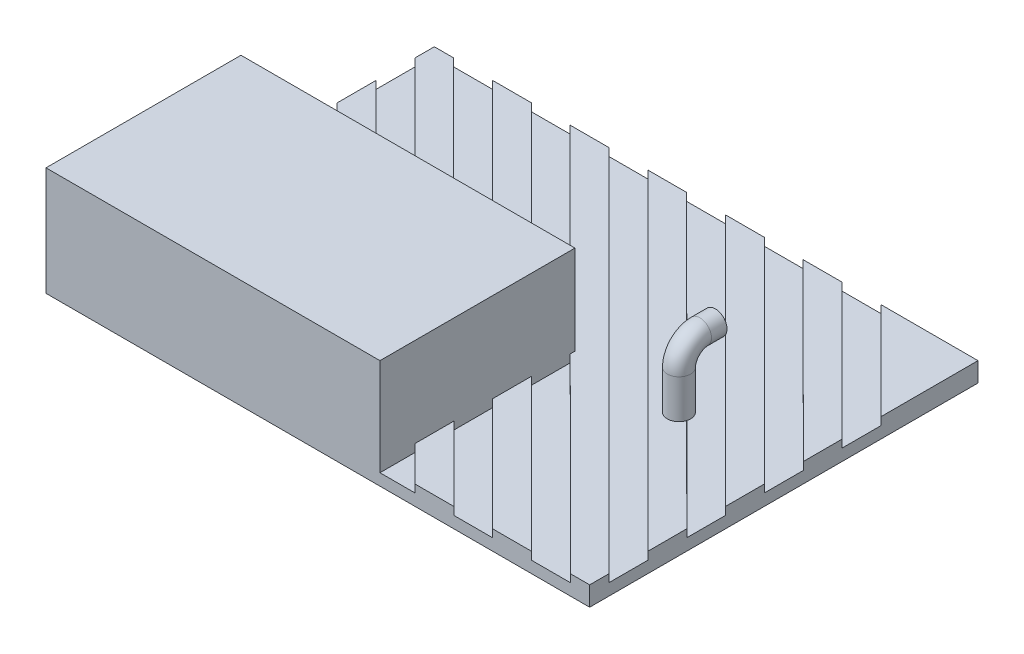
SolidWorks part; units mm, degrees
ref_plane "Front Plane" through (0, 0, 0) normal (0, 0, 1) x (1, 0, 0)
ref_plane "Top Plane" through (0, 0, 0) normal (0, 1, 0) x (1, 0, 0)
ref_plane "Right Plane" through (0, 0, 0) normal (1, 0, 0) x (0, 0, -1)
sketch "Sketch1" plane through (0, 0, 0) normal (0, 1, 0) x (1, 0, 0)
  line L1 (0, 0) -> (177.8, 0)
  line L2 (0, 0) -> (0, 127)
  line L3 (0, 127) -> (177.8, 127)
  line L4 (177.8, 0) -> (177.8, 127)
  dimension "D1" = 177.8
  dimension "D2" = 127
extrude "Boss-Extrude1" add sketch "Sketch1" along normal blind 6.35
sketch "Sketch2" plane through (0, 6.35, 0) normal (0, 1, 0) x (1, 0, 0)
  line L0 (0, 0) -> (177.8, 0) construction
  line L1 (0, 63.763) -> (12.7, 63.763)
  line L2 (0, 63.763) -> (0, 0)
  line L3 (0, 0) -> (12.7, 0)
  line L4 (12.7, 63.763) -> (12.7, 12.963)
  line L6 (96.52, 63.763) -> (109.22, 63.763)
  line L7 (96.52, 63.763) -> (96.52, 12.963)
  line L8 (88.9, 0) -> (109.22, 0)
  line L9 (109.22, 63.763) -> (109.22, 0)
  line L10 (12.7, 63.763) -> (96.52, 63.763) construction
  line L11 (12.7, 12.963) -> (96.52, 12.963)
  line L13 (12.7, 0) -> (88.9, 0)
  dimension "D1" = 83.82
  dimension "D2" = 50.8
  dimension "D3" = 12.7
  dimension "D4" = 12.7
extrude "Boss-Extrude2" add sketch "Sketch2" along normal blind 22.86
sketch "Sketch3" plane through (0, 29.21, 0) normal (0, 1, 0) x (1, 0, 0)
  line L1 (0, 0) -> (109.22, 0)
  line L2 (0, 0) -> (0, 63.763)
  line L3 (0, 63.763) -> (109.22, 63.763)
  line L4 (109.22, 0) -> (109.22, 63.763)
extrude "Boss-Extrude3" add sketch "Sketch3" along normal blind 6.35
sketch "Sketch4" plane through (0, 6.35, 0) normal (0, 1, 0) x (1, 0, 0)
  line L0 (88.9, 127) -> (88.9, 0) construction
  line L1 (177.8, 127) -> (0, 127) construction
  line L2 (0, 0) -> (109.22, 0) construction
  line L3 (0, 63.5) -> (177.8, 63.5) construction
  line L4 (0, 127) -> (0, 63.763) construction
  line L5 (177.8, 0) -> (177.8, 127) construction
  line L6 (109.22, 0) -> (109.22, 127) construction
  line L7 (143.51, 127) -> (143.51, 0) construction
  line L8 (109.22, 0) -> (177.8, 0) construction
  circle A0 centre (143.51, 63.5) radius 3.81
  dimension "D1" = 7.62
ref_plane "Plane2" through (139.7, 0, 0) normal (1, 0, 0) x (0, 0, -1)
sketch "Sketch6" plane through (139.7, 0, 0) normal (1, 0, 0) x (0, 0, -1)
  line L0 (63.5, 6.35) -> (63.5, 19.05)
  line L1 (70.3205, 25.8665) -> (75.3951, 25.8665)
  arc A0 (63.5, 19.05) -> (70.3205, 25.8665) centre (70.3165, 19.05) cw
  dimension "D1" = 12.7
sweep "Sweep1" add profiles "Sketch4" path "Sketch6"
sketch "Sketch9" plane through (0, 6.35, 0) normal (0, 1, 0) x (1, 0, 0)
  line L0 (146.05, 127) -> (177.8, 95.25)
  line L1 (177.8, 127) -> (0, 127) construction
  line L2 (177.8, 0) -> (177.8, 127) construction
  line L4 (177.8, 82.55) -> (133.35, 127)
  line L5 (133.35, 127) -> (146.05, 127)
  line L6 (177.8, 95.25) -> (303.5236, -30.4736)
  line L7 (303.5236, -30.4736) -> (303.5236, -43.1736)
  line L8 (303.5236, -43.1736) -> (177.8, 82.55)
  dimension "D1" = 12.7
  dimension "D2" = 12.7
  dimension "D3" = 31.75
  dimension "D4" = 31.75
  dimension "D5" = 12.7
  dimension "D6" = 177.8
extrude "Cut-Extrude2" cut sketch "Sketch9" against normal blind 2.54
pattern_linear "LPattern1" count 10 spacing 25.4 along (-1, 0, 0) of "Cut-Extrude2"
sketch "Sketch11" plane through (0, 6.35, 0) normal (0, 1, 0) x (1, 0, 0)
  line L1 (0, 0) -> (109.22, 0)
  line L2 (0, 0) -> (0, 63.763)
  line L3 (0, 63.763) -> (109.22, 63.763)
  line L4 (109.22, 0) -> (109.22, 63.763)
extrude "Boss-Extrude6" add sketch "Sketch11" against normal blind 2.54
